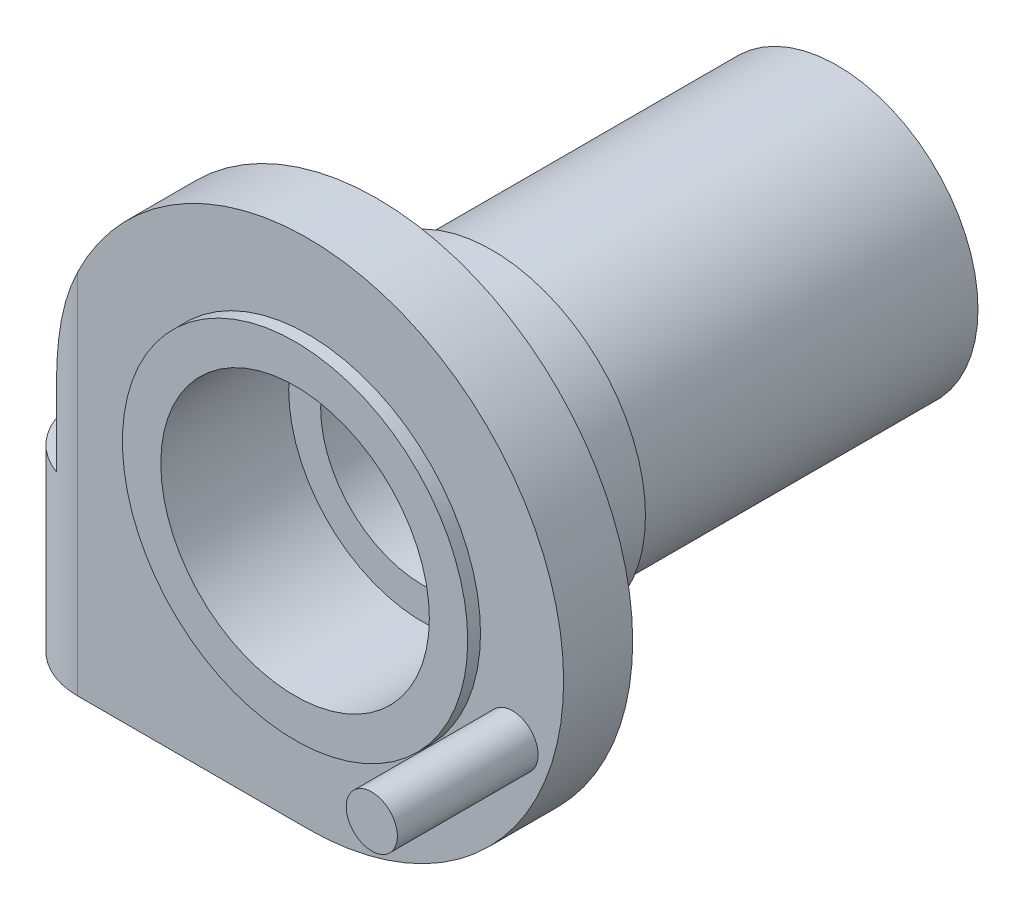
SolidWorks part; units mm, degrees
ref_plane "Plan1" through (0, 0, 0) normal (0, 0, 1) x (1, 0, 0)
ref_plane "Plan2" through (0, 0, 0) normal (0, 1, 0) x (1, 0, 0)
ref_plane "Plan3" through (0, 0, 0) normal (1, 0, 0) x (0, 0, -1)
sketch "Esquisse1" plane through (0, 0, 0) normal (0, 0, 1) x (1, 0, 0)
  circle A0 centre (0, 0) radius 5.5
  dimension "D1" = 11
extrude "Base-Extrusion" add sketch "Esquisse1" along normal blind 13.5
sketch "Esquisse2" plane through (0, 0, 13.5) normal (0, 0, 1) x (1, 0, 0)
  circle A0 centre (0, 0) radius 6
  dimension "D1" = 12
extrude "Boss.-Extru.1" add sketch "Esquisse2" along normal blind 4.5
sketch "Esquisse3" plane through (0, 0, 18) normal (0, 0, 1) x (1, 0, 0)
  line L0 (0, -10) -> (-12, -10)
  line L1 (-12, -10) -> (-12, -3)
  line L2 (-12, -3) -> (-10, -3)
  line L3 (-10, 0) -> (-10, -3)
  arc A0 (0, -10) -> (-10, 0) centre (0, 0) ccw
  circle A1 centre (0, 0) radius 6 construction
  dimension "D1" = 20
  dimension "D2" = 2
  dimension "D3" = 7
extrude "Boss.-Extru.2" add sketch "Esquisse3" along normal blind 2.7
sketch "Esquisse5" plane through (0, 0, 20.7) normal (0, 0, 1) x (1, 0, 0)
  circle A0 centre (0, 0) radius 6.75
  dimension "D1" = 13.5
extrude "Boss.-Extru.3" add sketch "Esquisse5" along normal blind 0.5
sketch "Esquisse6" plane through (0, 0, 0) normal (0, 0, -1) x (-1, 0, 0)
  circle A0 centre (0, 0) radius 4
  dimension "D1" = 8
extrude "Enlèv. mat.-Extru.1" cut sketch "Esquisse6" against normal through all
sketch "Esquisse7" plane through (0, 0, 21.2) normal (0, 0, 1) x (1, 0, 0)
  circle A0 centre (0, 0) radius 5.25
  dimension "D1" = 10.5
extrude "Enlèv. mat.-Extru.2" cut sketch "Esquisse7" against normal blind 5
sketch "Esquisse8" plane through (-12, 0, 0) normal (-1, 0, 0) x (0, 0, 1)
  line L0 (18, -3) -> (15.5, -3)
  line L1 (18, -10) -> (15.5, -10)
  line L2 (18, -3) -> (18, -10) construction
  line L3 (18, -3) -> (18, -10)
  arc A0 (15.5, -3) -> (15.5, -10) centre (15.5, -6.5) ccw
  dimension "D1" = 2.5
extrude "Boss.-Extru.4" add sketch "Esquisse8" against normal blind 2.7
sketch "Esquisse9" plane through (0, 0, 20.7) normal (0, 0, 1) x (1, 0, 0)
  line L0 (-12, -10) -> (0, -10) construction
  circle A0 centre (8, -3) radius 1
  circle A1 centre (0, 0) radius 5.25 construction
  dimension "D2" = 8
  dimension "D3" = 2
  dimension "D1" = 7
extrude "Boss.-Extru.5" add sketch "Esquisse9" along normal blind 5.5
sketch "Esquisse10" plane through (-12, 0, 0) normal (-1, 0, 0) x (0, 0, 1)
  circle A0 centre (15.5, -6.5) radius 2
  dimension "D1" = 4
extrude "Enlèv. mat.-Extru.3" cut sketch "Esquisse10" against normal up to next
fillet "Congé1" radius 3
fillet "Congé2" radius 1
